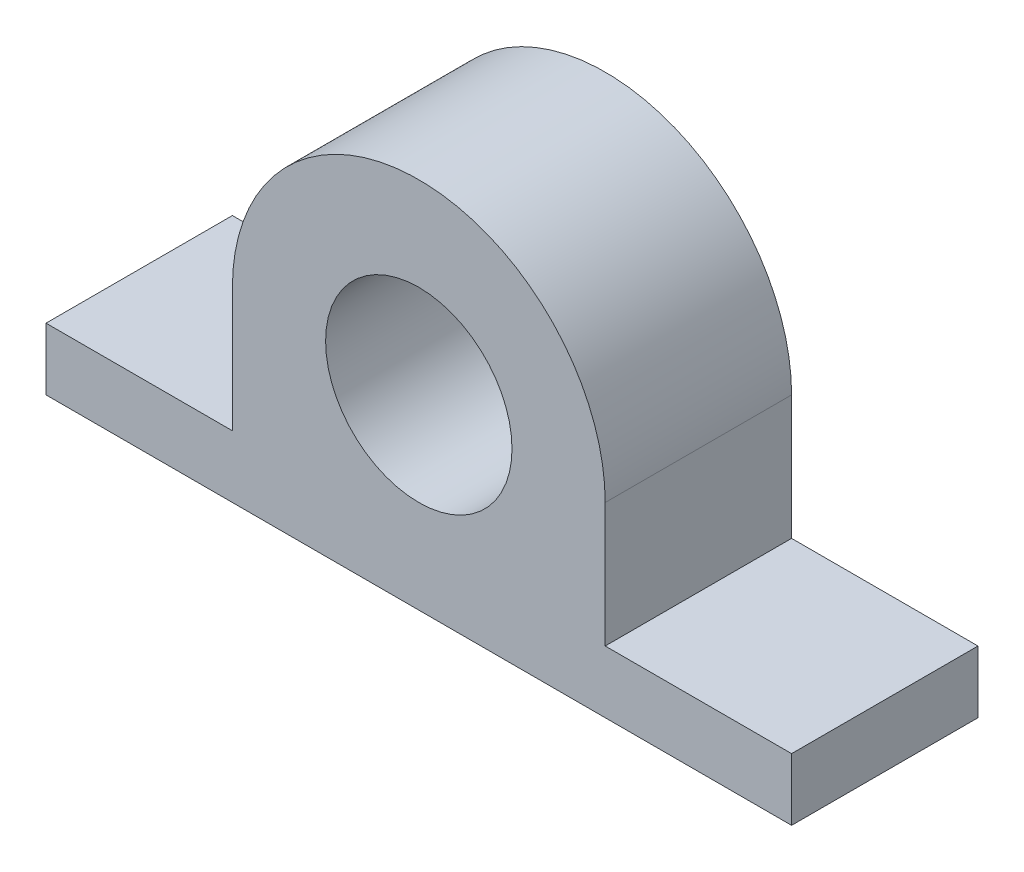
SolidWorks part; units mm, degrees
ref_plane "Front Plane" through (0, 0, 0) normal (0, 0, 1) x (1, 0, 0)
ref_plane "Top Plane" through (0, 0, 0) normal (0, 1, 0) x (1, 0, 0)
ref_plane "Right Plane" through (0, 0, 0) normal (1, 0, 0) x (0, 0, -1)
sketch "Sketch1" plane through (0, 0, 0) normal (0, 0, 1) x (1, 0, 0)
  line L0 (10, 10) -> (130, 10)
  line L1 (130, 10) -> (130, 20)
  line L2 (130, 20) -> (100, 20)
  line L3 (100, 20) -> (100, 40)
  line L4 (40, 40) -> (40, 20)
  line L5 (40, 20) -> (10, 20)
  line L6 (10, 20) -> (10, 10)
  arc A0 (100, 40) -> (40, 40) centre (70, 40) ccw
  circle A1 centre (70, 40) radius 15
  dimension "D5" = 30
  dimension "D6" = 10
  dimension "D3" = 30
  dimension "D1" = 120
  dimension "D2" = 10
  dimension "D4" = 30
  dimension "D7" = 10
extrude "Boss-Extrude1" add sketch "Sketch1" along normal blind 30 contours A1 | L5 L6 L0 L1 L2 L3 A0 L4
